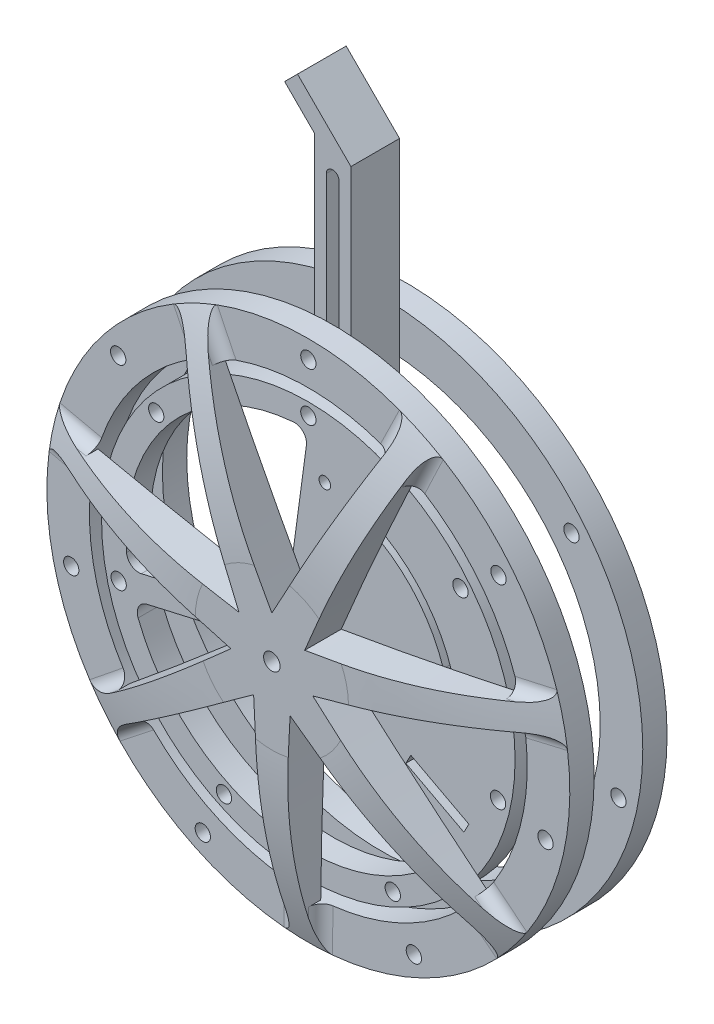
SolidWorks part; units mm, degrees
other "<inner>-<Boss-Extrude2>"
other "<inner>-<LPattern1>"
other "<inner>-<Fillet1>"
other "<inner>-<Fillet5>"
ref_plane "Front Plane" through (0, 0, 0) normal (0, 0, 1) x (1, 0, 0)
ref_plane "Top Plane" through (0, 0, 0) normal (0, 1, 0) x (1, 0, 0)
ref_plane "Right Plane" through (0, 0, 0) normal (1, 0, 0) x (0, 0, -1)
mirrored part "inner_Mirrored"
